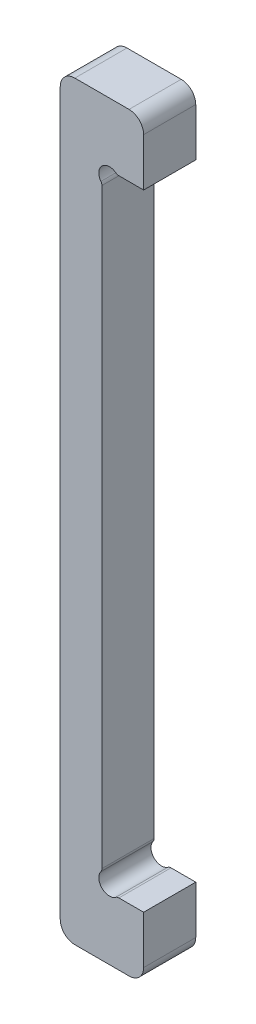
SolidWorks part; units mm, degrees
ref_plane "Plan de face" through (0, 0, 0) normal (0, 0, 1) x (1, 0, 0)
ref_plane "Plan de dessus" through (0, 0, 0) normal (0, 1, 0) x (1, 0, 0)
ref_plane "Plan de droite" through (0, 0, 0) normal (1, 0, 0) x (0, 0, -1)
sketch "Esquisse2" plane through (0, 0, 0) normal (0, 0, 1) x (1, 0, 0)
  line L0 (11.869, 149.9) -> (0, 149.9) construction
  line L3 (40, 150) -> (28.131, 150)
  line L4 (20, 141.869) -> (20, 0)
  line L5 (20, 150) -> (23.6062, 146.3938) construction
  line L6 (40, 180) -> (0, 180)
  line L7 (0, 180) -> (0, 0)
  line L9 (20, 0) -> (0, 0)
  line L19 (40, 180) -> (40, 150)
  arc A0 (26.6426, 150.4914) -> (19.5086, 143.3574) centre (23.6062, 146.3938) ccw
  arc A1 (26.6426, 150.4914) -> (28.131, 150) centre (28.131, 152.5) ccw
  arc A2 (19.5086, 143.3574) -> (20, 141.869) centre (17.5, 141.869) cw
  point P15 (20, 0)
  point P23 (20, 180)
extrude "Boss.-Extru.2" add sketch "Esquisse2" along normal blind 25
fillet "Congé1" radius 7 2 edges at (40, 180, 12.5) (0, 180, 12.5)
mirror "Mirror1" about plane through (20, 0, 25) normal (0, 1, 0)
ref_plane "Plane1" through (0, 0, 0) normal (0, 1, 0) x (1, 0, 0)
equation "\"D1@Boss.-Extru.2\" = \"material_thickness\""
equation "\"tool_diameter\"=10"
equation "\"hole_clearance\"=0.1"
equation "\"material_thickness\"=25"
equation "\"clearance\"=0.1"
equation "\"outer_slot\"=0.5"
equation "\"fillet\"=7"
equation "\"string\"= 2 * \"tool_diameter\" / 2 * cos ( 45deg )"
equation "\"angle\"= IIF ( \"string\" < \"limit\" , 45 , ( 180 - 2 * arcsin ( \"ThicknessVStool_dia\" ) ) / 2 )"
equation "\"limit\"= \"material_thickness\" / 2 * 5 / 6"
equation "\"ThicknessVStool_dia\"= IIF ( \"limit\" / \"tool_diameter\" > 1 , 1 , \"limit\" / \"tool_diameter\" )"
equation "\"D4@Esquisse2\"=\"tool_diameter\" / 2 + \"hole_clearance\""
equation "\"D5@Esquisse2\"=\"material_thickness\"/10"
equation "\"D1@Congé1\"=\"fillet\""
equation "\"D6@Esquisse2\"=\"clearance\""
